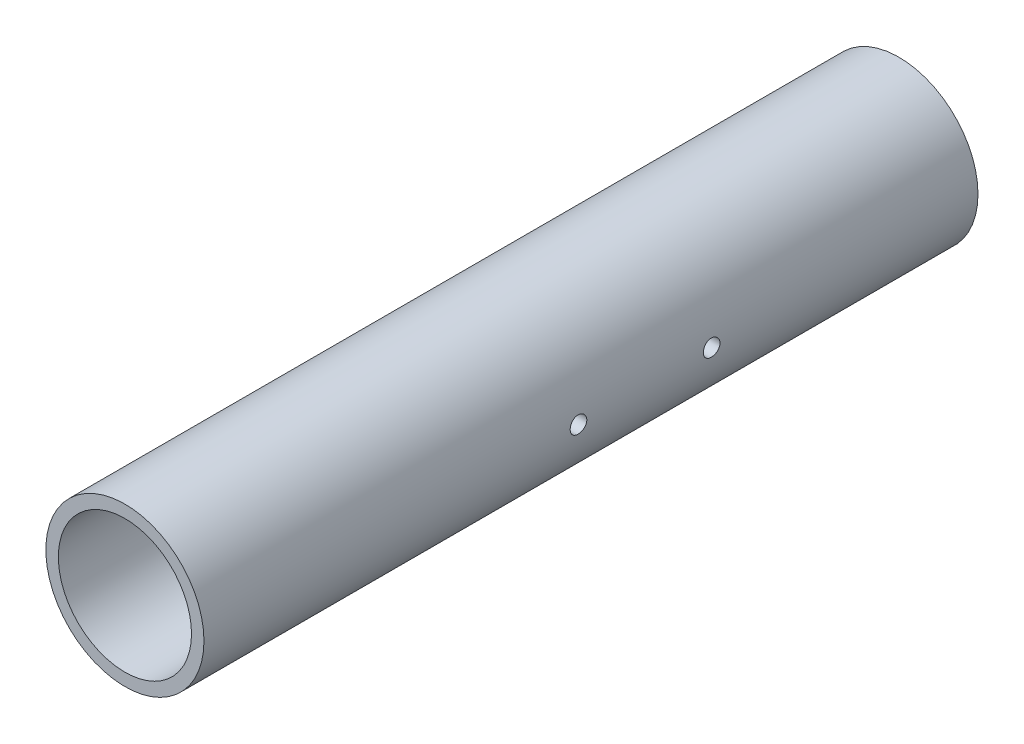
SolidWorks part; units mm, degrees
ref_plane "Front Plane" through (0, 0, 0) normal (0, 0, 1) x (1, 0, 0)
ref_plane "Top Plane" through (0, 0, 0) normal (0, 1, 0) x (1, 0, 0)
ref_plane "Right Plane" through (0, 0, 0) normal (1, 0, 0) x (0, 0, -1)
sketch "Sketch1" plane through (0, 0, 0) normal (0, 0, 1) x (1, 0, 0)
  circle A0 centre (0, 0) radius 30.1625
  circle A1 centre (0, 0) radius 25.4
  dimension "D1" = 60.325
  dimension "D2" = 50.8
extrude "Boss-Extrude1" add sketch "Sketch1" along normal blind 295.275
sketch "Sketch2" plane through (0, 0, 0) normal (1, 0, 0) x (0, 0, -1)
  line L0 (-295.275, 0) -> (0, 0) construction
  line L1 (-295.275, 30.1625) -> (-295.275, -30.1625) construction
  line L2 (0, -30.1625) -> (0, 30.1625) construction
  circle A0 centre (-152.4, 0) radius 3.175
  circle A1 centre (-101.6, 0) radius 3.175
  dimension "D1" = 6.35
  dimension "D2" = 6.35
  dimension "D3" = 50.8
  dimension "D4" = 101.6
extrude "Cut-Extrude1" cut sketch "Sketch2" against normal through all both and the other way through all
sketch "Sketch3" plane through (0, 0, 295.275) normal (0, 0, 1) x (1, 0, 0)
  line L0 (0, -30.1625) -> (0, 30.1625) construction
  line L1 (-30.1625, 0) -> (30.1625, 0) construction
  circle A0 centre (0, 0) radius 30.1625 construction
